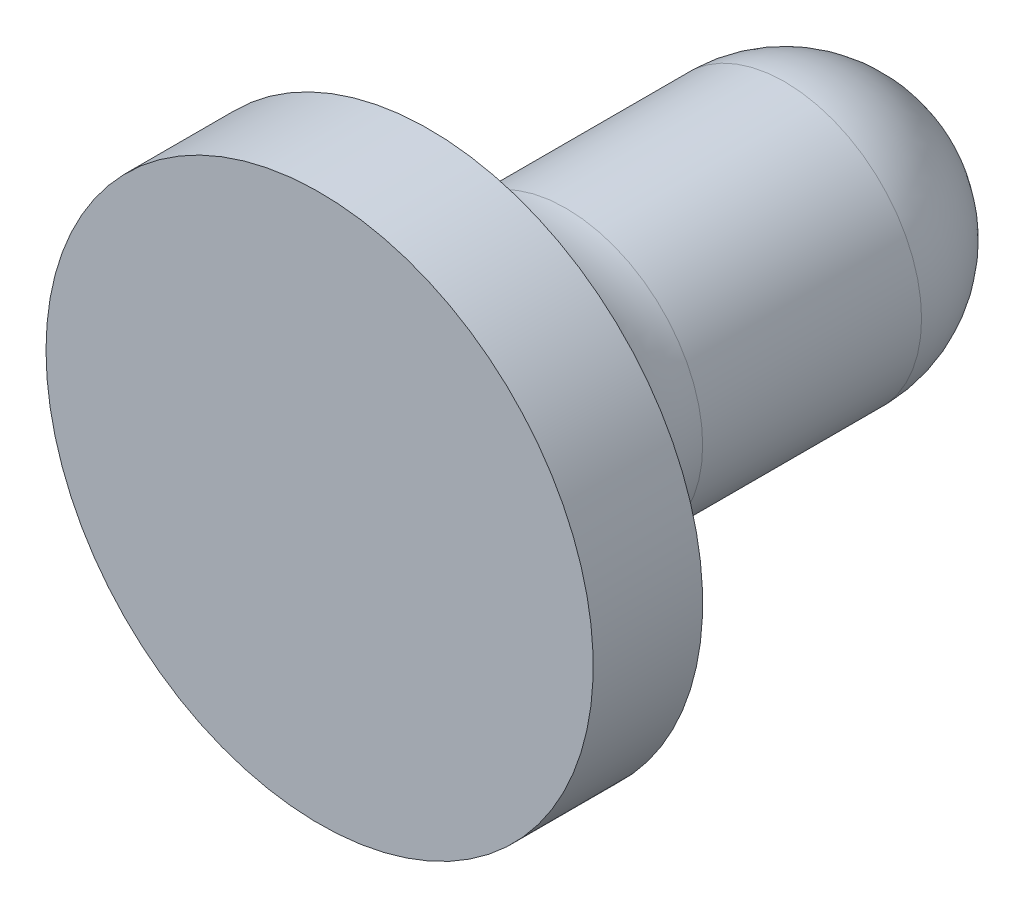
SolidWorks part; units mm, degrees
ref_plane "前视基准面" through (0, 0, 0) normal (0, 0, 1) x (1, 0, 0)
ref_plane "上视基准面" through (0, 0, 0) normal (0, 1, 0) x (1, 0, 0)
ref_plane "右视基准面" through (0, 0, 0) normal (1, 0, 0) x (0, 0, -1)
other "Configuration Table"
sketch "草图1" plane through (0, 0, 0) normal (0, 1, 0) x (1, 0, 0)
  line L0 (0, 0) -> (50, 0)
  line L1 (50, 0) -> (50, 20)
  line L2 (25, 45) -> (25, 85)
  line L3 (0, 110) -> (0, 0)
  arc A0 (50, 20) -> (25, 45) centre (50, 45) cw
  arc A1 (25, 85) -> (0, 110) centre (0, 85) ccw
  point P4 (50, 45)
revolve "旋转1" add sketch "草图1" angle 360 about L3
